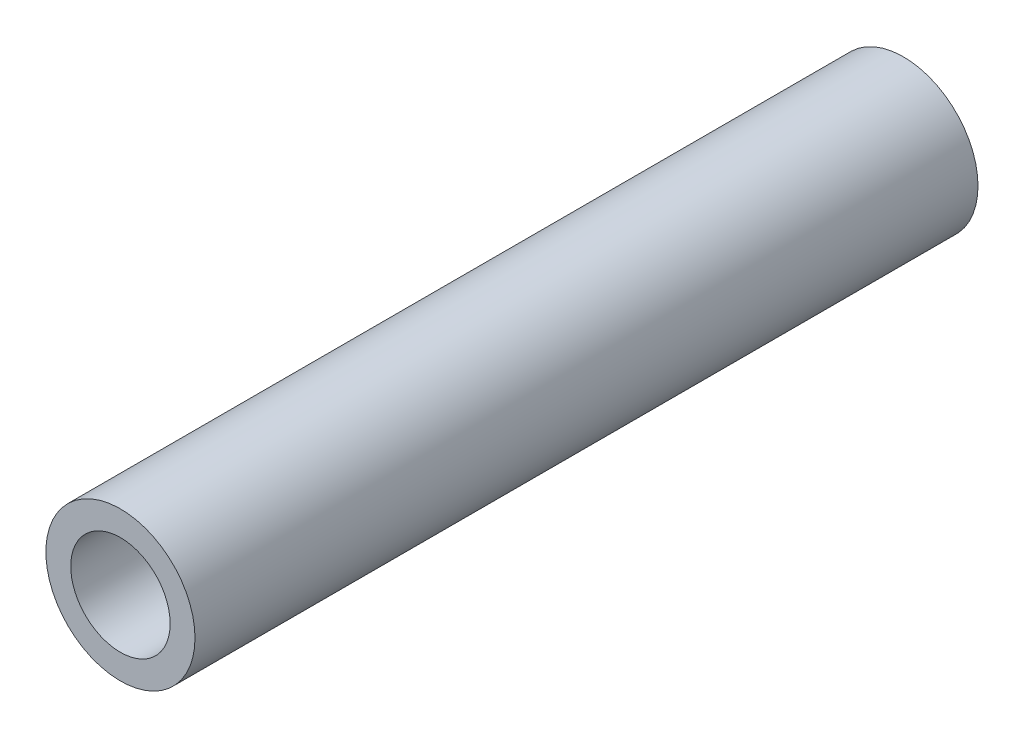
SolidWorks part; units mm, degrees
ref_plane "Plan de face" through (0, 0, 0) normal (0, 0, 1) x (1, 0, 0)
ref_plane "Plan de dessus" through (0, 0, 0) normal (0, 1, 0) x (1, 0, 0)
ref_plane "Plan de droite" through (0, 0, 0) normal (1, 0, 0) x (0, 0, -1)
sketch "Esquisse1" plane through (0, 0, 0) normal (0, 0, 1) x (1, 0, 0)
  circle A0 centre (0, 0) radius 3
  circle A1 centre (0, 0) radius 2
extrude "Extrusion1" add sketch "Esquisse1" along normal blind 31.5
